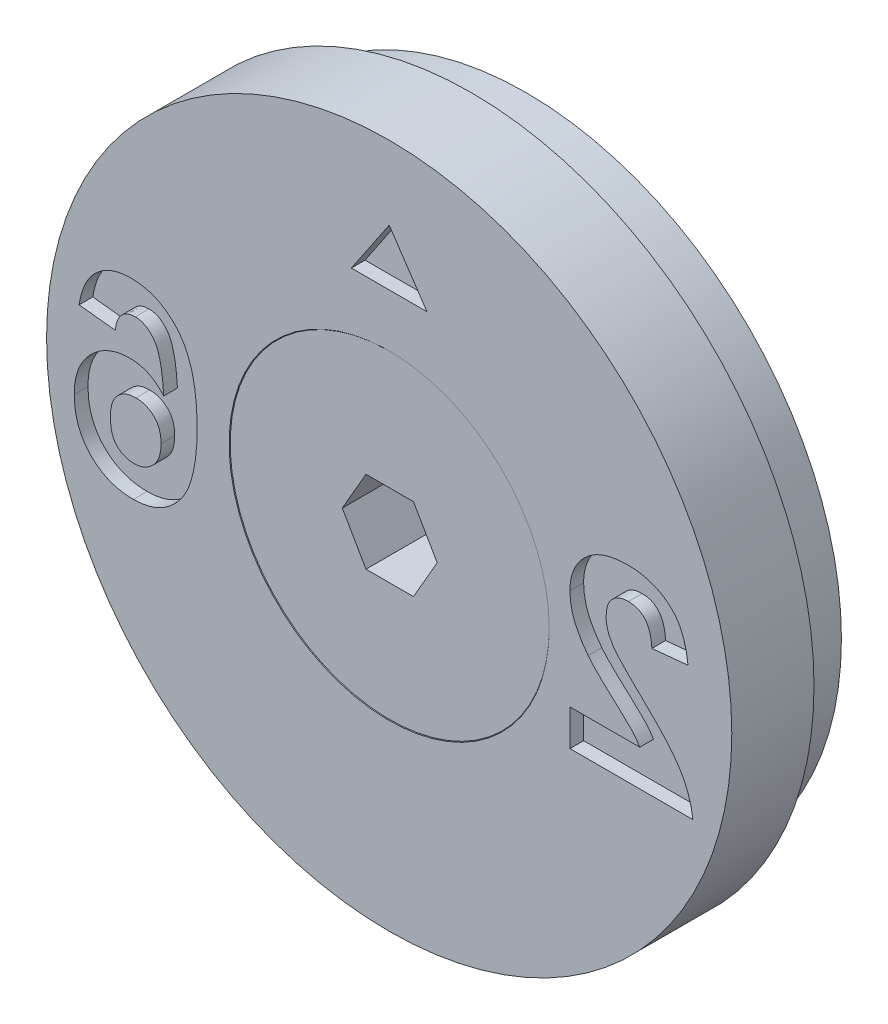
SolidWorks part; units mm, degrees
other "<M5 X .8 FHCS>-<Imported1>"
ref_plane "Front Plane" through (0, 0, 0) normal (0, 0, 1) x (1, 0, 0)
ref_plane "Top Plane" through (0, 0, 0) normal (0, 1, 0) x (1, 0, 0)
ref_plane "Right Plane" through (0, 0, 0) normal (1, 0, 0) x (0, 0, -1)
imported_body "Imported1"
sketch "Sketch1" plane through (0, 0, 0) normal (0, 0, 1) x (1, 0, 0)
  text T0 "2     6" font "Arial" height 6.858
  dimension "D1" = 3.429
  dimension "D2" = 11.43
extrude "Cut-Extrude1" cut sketch "Sketch1" against normal blind 0.5
inserted part "M5 X .8 FHCS"
move or copy body "Body-Move/Copy2" placed by mates yes
